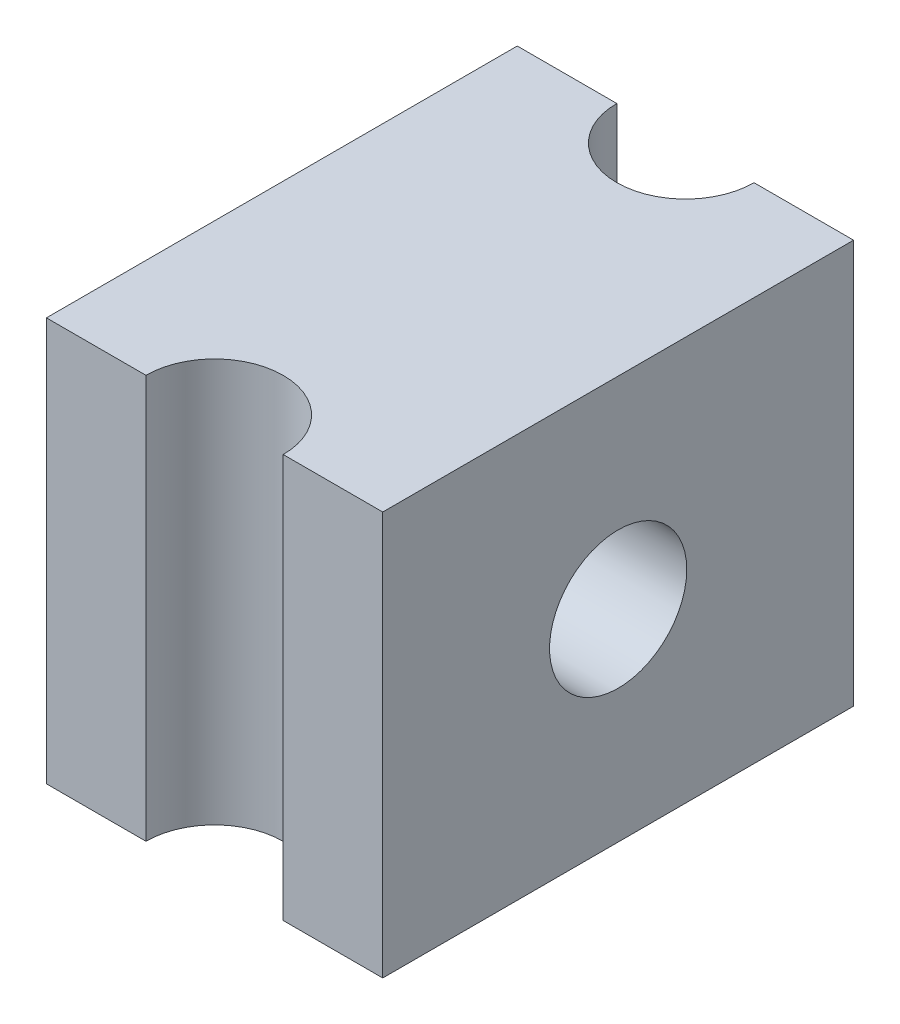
SolidWorks part; units mm, degrees
ref_plane "Plan de face" through (0, 0, 0) normal (0, 0, 1) x (1, 0, 0)
ref_plane "Plan de dessus" through (0, 0, 0) normal (0, 1, 0) x (1, 0, 0)
ref_plane "Plan de droite" through (0, 0, 0) normal (1, 0, 0) x (0, 0, -1)
sketch "Esquisse1" plane through (0, 0, 0) normal (1, 0, 0) x (0, 0, -1)
  line L0 (-17.5, 15) -> (17.5, -15) construction
  line L1 (-17.5, 15) -> (17.5, 15)
  line L2 (-17.5, 15) -> (-17.5, -15)
  line L3 (-17.5, -15) -> (17.5, -15)
  line L4 (17.5, 15) -> (17.5, -15)
  circle A0 centre (0, 0) radius 5.1
  dimension "D1" = 10.2
  dimension "D2" = 35
  dimension "D3" = 30
extrude "Extrusion1" add sketch "Esquisse1" along normal blind 25
sketch "Esquisse2" plane through (0, 15, 0) normal (0, 1, 0) x (-1, 0, 0)
  line L0 (-25, -17.5) -> (0, -17.5) construction
  line L1 (-25, 17.5) -> (0, 17.5) construction
  line L2 (-7.4, 17.5) -> (-17.6, 17.5)
  line L3 (-7.4, -17.5) -> (-17.6, -17.5)
  arc A0 (-7.4, -17.5) -> (-17.6, -17.5) centre (-12.5, -17.5) ccw
  arc A1 (-17.6, 17.5) -> (-7.4, 17.5) centre (-12.5, 17.5) ccw
  dimension "D1" = 5.1
extrude "Enlèv. mat.-Extru.1" cut sketch "Esquisse2" against normal through all
